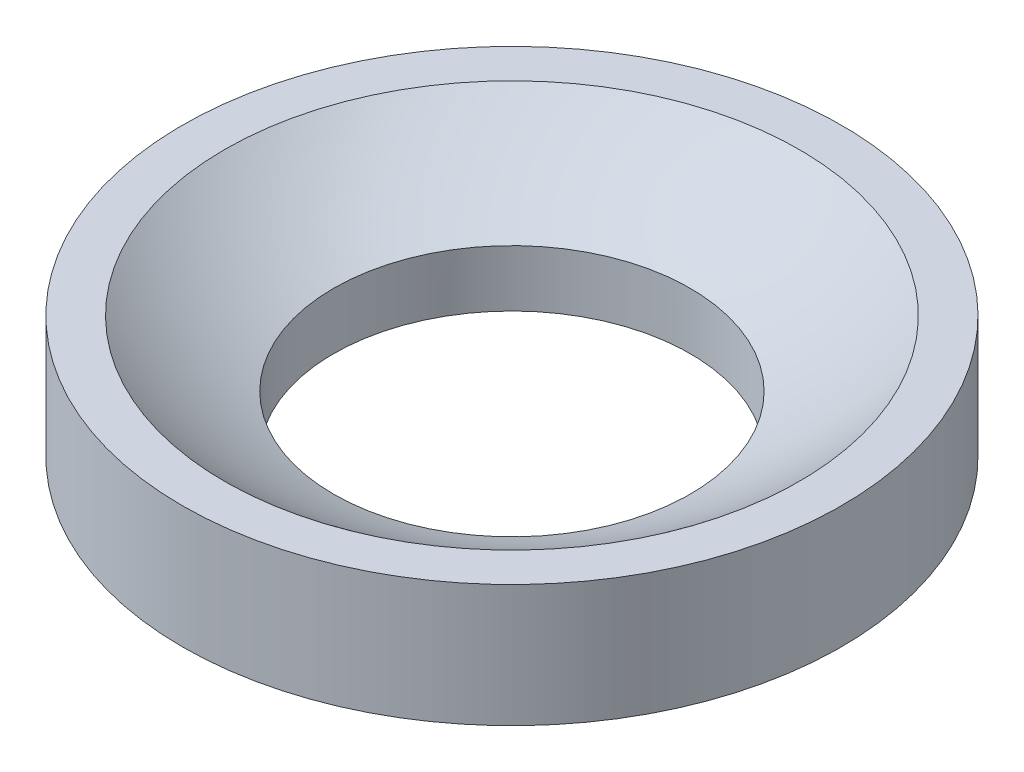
SolidWorks part; units mm, degrees
ref_plane "Plan1" through (0, 0, 0) normal (0, 0, 1) x (1, 0, 0)
ref_plane "Plan2" through (0, 0, 0) normal (0, 1, 0) x (1, 0, 0)
ref_plane "Plan3" through (0, 0, 0) normal (1, 0, 0) x (0, 0, -1)
sketch "Esquisse2" plane through (0, 0, 0) normal (0, 0, 1) x (1, 0, 0)
  line L0 (474.9402, 265.5785) -> (474.9402, 248.3133) construction
  line L1 (468.5802, 261.2185) -> (468.5802, 263.2385)
  line L4 (463.1862, 265.5785) -> (464.6902, 265.5785)
  line L5 (463.1862, 261.2185) -> (468.5802, 261.2185)
  line L7 (463.1862, 261.2185) -> (463.1862, 265.5785)
  arc A0 (468.5802, 263.2385) -> (464.6902, 265.5785) centre (474.9402, 278.2147) cw
  dimension "D1" = 10.25
  dimension "D2" = 6.36
  dimension "D3" = 4.36
revolve "Base-Révolution" add sketch "Esquisse2" angle 360 about L0
